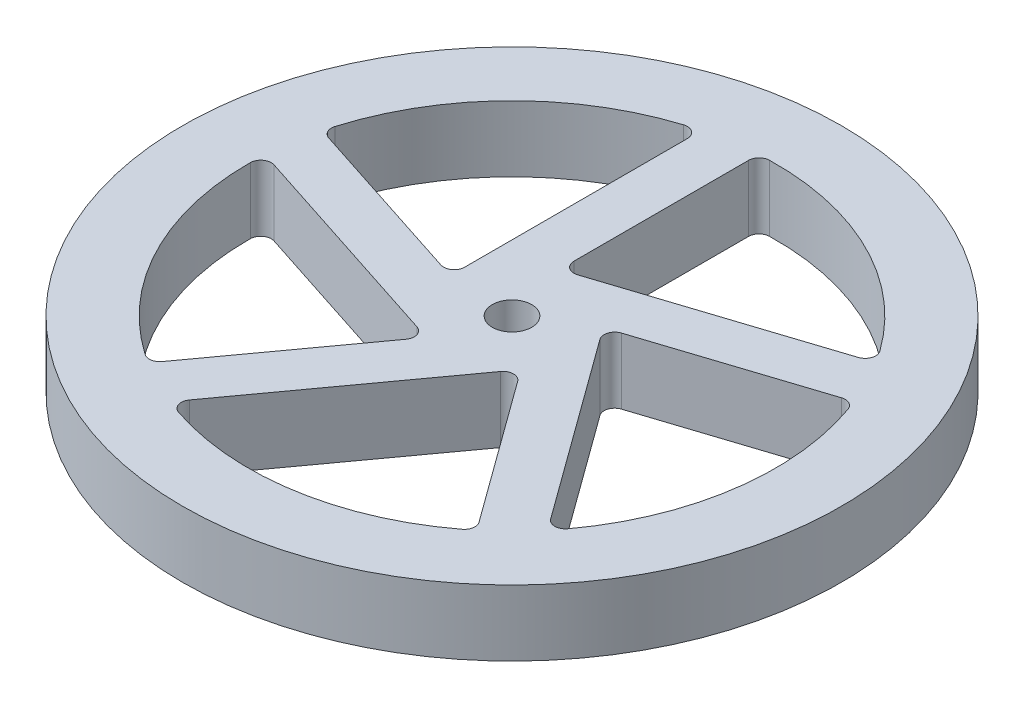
SolidWorks part; units mm, degrees
ref_plane "Front Plane" through (0, 0, 0) normal (0, 0, 1) x (1, 0, 0)
ref_plane "Top Plane" through (0, 0, 0) normal (0, 1, 0) x (1, 0, 0)
ref_plane "Right Plane" through (0, 0, 0) normal (1, 0, 0) x (0, 0, -1)
sketch "Sketch1" plane through (0, 0, 0) normal (0, 1, 0) x (1, 0, 0)
  circle A0 centre (0, 0) radius 31.75
  dimension "D1" = 63.5
extrude "Boss-Extrude1" add sketch "Sketch1" along normal mid plane 6.35
hole_wizard "#6 Clearance Hole1" positions "Sketch3" profile "Sketch2" hole size "#6" standard "ANSI Inch"
sketch "Sketch3" plane through (0, 3.175, 0) normal (0, 1, 0) x (1, 0, 0)
  point P0 (0, 0)
sketch "Sketch2" plane through (0, 3.175, 0) normal (1, 0, 0) x (0, 0, 1)
  line L0 (0, 0) -> (0, 6.35)
  line L1 (0, 6.35) -> (1.8986, 6.35)
  line L2 (1.8986, 6.35) -> (1.8986, 0)
  line L5 (1.8986, 0) -> (0, 0)
  line L11 (0, -6.35) -> (0, 107.95) construction
  dimension "Thru Hole Dia." = 3.7973
  dimension "Thru Hole Depth" = 6.35
sketch "Sketch4" plane through (0, 3.175, 0) normal (0, 1, 0) x (1, 0, 0)
  line L0 (-6.35, 0) -> (-6.35, 24.5934)
  line L1 (-1.5875, 6.1484) -> (-1.5875, 25.3503)
  line L2 (-1.9623, 6.0392) -> (21.4275, 13.639)
  line L3 (5.3569, 3.4098) -> (23.619, 9.3435)
  line L4 (5.1373, 3.7324) -> (19.5929, -16.1641)
  line L5 (4.8982, -4.041) -> (16.1849, -19.5757)
  line L6 (5.1373, -3.7324) -> (-9.3184, -23.629)
  line L7 (-2.3296, -5.9072) -> (-13.6162, -21.442)
  line L8 (-1.9623, -6.0392) -> (-25.352, 1.5606)
  line L9 (-6.338, 0.3901) -> (-24.6002, 6.3239)
  circle A0 centre (0, 0) radius 25.4
  circle A1 centre (0, 0) radius 6.35
  circle A2 centre (0, 0) radius 31.75 construction
  point P29 (0, 0)
  dimension "D2" = 12.7
  dimension "D3" = 6.35
  dimension "D1" = 4.7625
  dimension "D4" = 5
extrude "Cut-Extrude1" cut sketch "Sketch4" against normal up to surface (6.35 mm away) contours L0 A0 L9 | L2 A0 L1 | L4 A0 L3 | L6 A0 L5 | L8 A0 L7
fillet "Fillet1" radius 1.016 15 edges at (-24.6002, 0, -6.3239) (-6.35, 0, -24.5934) (-6.35, 0, -0.394) (-1.5875, 0, -25.3503) (-1.5875, 0, -6.161) (23.619, 0, -9.3435) (19.5929, 0, 16.1641) (5.3689, 0, -3.4136) (-9.3184, 0, 23.629) (4.9056, 0, 4.0512) (-13.6162, 0, 21.442) (-25.352, 0, -1.5606) (-2.337, 0, 5.9174) (16.1849, 0, 19.5757) (21.4275, 0, -13.639)
sketch "Sketch5" plane through (0, 3.175, 0) normal (0, 1, 0) x (1, 0, 0)
  line L5 (-6.35, 1.7924) -> (-6.35, 23.2448)
  line L6 (-23.6748, 6.0232) -> (-7.68, 0.8262)
  line L7 (-6.35, 1.7924) -> (-6.35, 23.2448)
  line L8 (-23.6748, 6.0232) -> (-7.68, 0.8262)
  line L9 (-0.2575, 6.5931) -> (20.1449, 13.2223)
  line L10 (-1.5875, 24.3773) -> (-1.5875, 7.5594)
  line L11 (-0.2575, 6.5931) -> (20.1449, 13.2223)
  line L12 (-1.5875, 24.3773) -> (-1.5875, 7.5594)
  line L13 (6.1908, 2.2823) -> (18.8002, -15.073)
  line L14 (22.6936, 9.0428) -> (6.6988, 3.8458)
  line L15 (6.1908, 2.2823) -> (18.8002, -15.073)
  line L16 (22.6936, 9.0428) -> (6.6988, 3.8458)
  line L17 (4.0837, -5.1826) -> (-8.5257, -22.5379)
  line L18 (15.6129, -18.7885) -> (5.7276, -5.1826)
  line L19 (4.0837, -5.1826) -> (-8.5257, -22.5379)
  line L20 (15.6129, -18.7885) -> (5.7276, -5.1826)
  line L21 (-3.667, -5.4853) -> (-24.0694, 1.1438)
  line L22 (-13.0443, -20.6548) -> (-3.159, -7.0488)
  line L23 (-3.667, -5.4853) -> (-24.0694, 1.1438)
  line L24 (-13.0443, -20.6548) -> (-3.159, -7.0488)
  circle A2 centre (0, 0) radius 31.8516
  circle A3 centre (0, 0) radius 31.8516
  circle A7 centre (0, 0) radius 1.6446
  circle A8 centre (0, 0) radius 1.6446
  arc A9 (-7.68, 0.8262) -> (-6.35, 1.7924) centre (-7.366, 1.7924) ccw
  arc A10 (-24.3342, 7.2807) -> (-23.6748, 6.0232) centre (-23.3608, 6.9895) ccw
  arc A11 (-7.6729, 24.2134) -> (-24.3342, 7.2807) centre (0, 0) ccw
  arc A12 (-6.35, 23.2448) -> (-7.6729, 24.2134) centre (-7.366, 23.2448) ccw
  arc A13 (-7.68, 0.8262) -> (-6.35, 1.7924) centre (-7.366, 1.7924) ccw
  arc A14 (-24.3342, 7.2807) -> (-23.6748, 6.0232) centre (-23.3608, 6.9895) ccw
  arc A15 (-7.6729, 24.2134) -> (-24.3342, 7.2807) centre (0, 0) ccw
  arc A16 (-6.35, 23.2448) -> (-7.6729, 24.2134) centre (-7.366, 23.2448) ccw
  arc A17 (-1.5875, 7.5594) -> (-0.2575, 6.5931) centre (-0.5715, 7.5594) ccw
  arc A18 (-0.5953, 25.393) -> (-1.5875, 24.3773) centre (-0.5715, 24.3773) ccw
  arc A19 (20.6572, 14.7797) -> (-0.5953, 25.393) centre (0, 0) ccw
  arc A20 (20.1449, 13.2223) -> (20.6572, 14.7797) centre (19.8309, 14.1885) ccw
  arc A21 (-1.5875, 7.5594) -> (-0.2575, 6.5931) centre (-0.5715, 7.5594) ccw
  arc A22 (-0.5953, 25.393) -> (-1.5875, 24.3773) centre (-0.5715, 24.3773) ccw
  arc A23 (20.6572, 14.7797) -> (-0.5953, 25.393) centre (0, 0) ccw
  arc A24 (20.1449, 13.2223) -> (20.6572, 14.7797) centre (19.8309, 14.1885) ccw
  arc A25 (6.6988, 3.8458) -> (6.1908, 2.2823) centre (7.0128, 2.8795) ccw
  arc A26 (23.9662, 8.4131) -> (22.6936, 9.0428) centre (23.0076, 8.0765) ccw
  arc A27 (20.4398, -15.079) -> (23.9662, 8.4131) centre (0, 0) ccw
  arc A28 (18.8002, -15.073) -> (20.4398, -15.079) centre (19.6222, -14.4758) ccw
  arc A29 (6.6988, 3.8458) -> (6.1908, 2.2823) centre (7.0128, 2.8795) ccw
  arc A30 (23.9662, 8.4131) -> (22.6936, 9.0428) centre (23.0076, 8.0765) ccw
  arc A31 (20.4398, -15.079) -> (23.9662, 8.4131) centre (0, 0) ccw
  arc A32 (18.8002, -15.073) -> (20.4398, -15.079) centre (19.6222, -14.4758) ccw
  arc A33 (5.7276, -5.1826) -> (4.0837, -5.1826) centre (4.9056, -5.7797) ccw
  arc A34 (15.4073, -20.1935) -> (15.6129, -18.7885) centre (14.791, -19.3857) ccw
  arc A35 (-8.0247, -24.099) -> (15.4073, -20.1935) centre (0, 0) ccw
  arc A36 (-8.5257, -22.5379) -> (-8.0247, -24.099) centre (-7.7037, -23.1351) ccw
  arc A37 (5.7276, -5.1826) -> (4.0837, -5.1826) centre (4.9056, -5.7797) ccw
  arc A38 (15.4073, -20.1935) -> (15.6129, -18.7885) centre (14.791, -19.3857) ccw
  arc A39 (-8.0247, -24.099) -> (15.4073, -20.1935) centre (0, 0) ccw
  arc A40 (-8.5257, -22.5379) -> (-8.0247, -24.099) centre (-7.7037, -23.1351) ccw
  arc A41 (-3.159, -7.0488) -> (-3.667, -5.4853) centre (-3.9809, -6.4516) ccw
  arc A42 (-14.444, -20.8933) -> (-13.0443, -20.6548) centre (-13.8663, -20.0576) ccw
  arc A43 (-25.3993, 0.185) -> (-14.444, -20.8933) centre (0, 0) ccw
  arc A44 (-24.0694, 1.1438) -> (-25.3993, 0.185) centre (-24.3834, 0.1776) ccw
  arc A45 (-3.159, -7.0488) -> (-3.667, -5.4853) centre (-3.9809, -6.4516) ccw
  arc A46 (-14.444, -20.8933) -> (-13.0443, -20.6548) centre (-13.8663, -20.0576) ccw
  arc A47 (-25.3993, 0.185) -> (-14.444, -20.8933) centre (0, 0) ccw
  arc A48 (-24.0694, 1.1438) -> (-25.3993, 0.185) centre (-24.3834, 0.1776) ccw
  dimension "D1" = 0.1016
  dimension "D2" = 0
  dimension "D3" = 0
  dimension "D4" = 0
  dimension "D5" = 0
  dimension "D6" = 0
  dimension "D7" = 0.254
